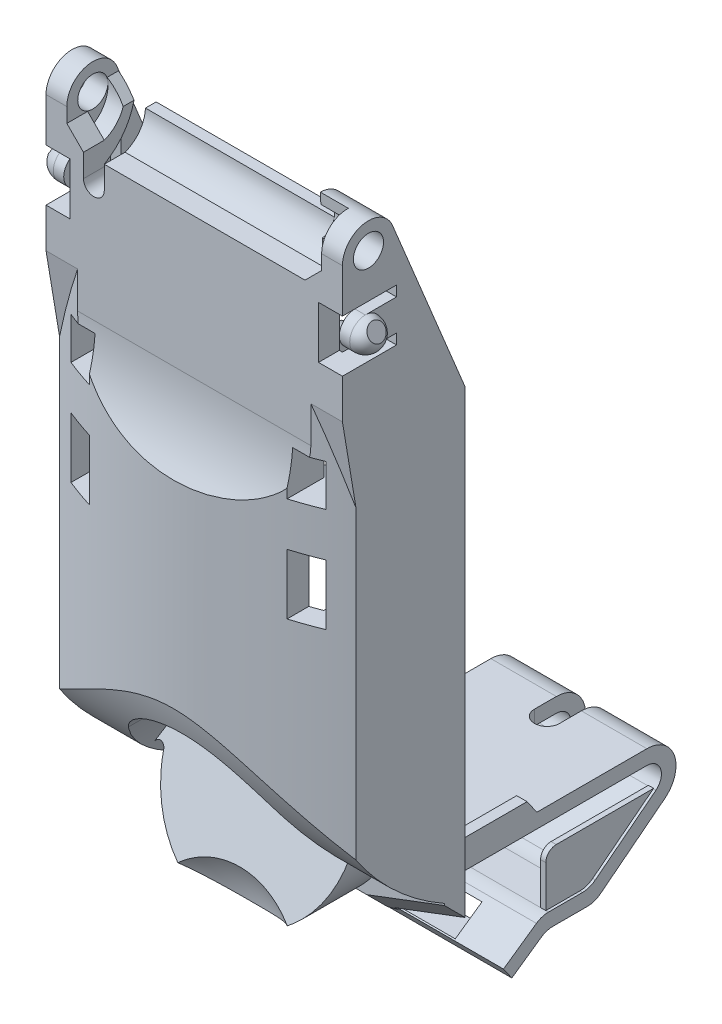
SolidWorks part; units mm, degrees
ref_plane "正面" through (0, 0, 0) normal (0, 0, 1) x (1, 0, 0)
ref_plane "平面" through (0, 0, 0) normal (0, 1, 0) x (1, 0, 0)
ref_plane "右側面" through (0, 0, 0) normal (1, 0, 0) x (0, 0, -1)
imported_body "Cartridge Cover.stp"
sketch "ｽｹｯﾁ3" plane through (9.5, 0, 0) normal (1, 0, 0) x (0, 0, -1)
  line L0 (-7.3, -5.5) -> (-8.8, -5.5)
  line L2 (-8.8, -4) -> (-8.8, -5.5)
  arc A0 (-8.8, -4) -> (-7.3, -5.5) centre (-7.3, -4) ccw construction
  arc A1 (-8.8, -4) -> (-7.3, -5.5) centre (-7.3, -4) ccw
extrude "ｶｯﾄ - 押し出し1" cut sketch "ｽｹｯﾁ3" against normal up to surface (19 mm away)
sketch "ｽｹｯﾁ7" plane through (14.25, 0, 0) normal (1, 0, 0) x (0, 0, -1)
  circle A0 centre (-9.3, 16) radius 1.45
  dimension "D1" = 2.9
extrude "ｶｯﾄ - 押し出し3" cut sketch "ｽｹｯﾁ7" against normal up to surface (4.7 mm away)
sketch "ｽｹｯﾁ8" plane through (-14.25, 0, 0) normal (-1, 0, 0) x (0, 0, 1)
  circle A0 centre (9.3, 16) radius 1.45
  dimension "D1" = 2.9
extrude "ｶｯﾄ - 押し出し4" cut sketch "ｽｹｯﾁ8" against normal up to next
